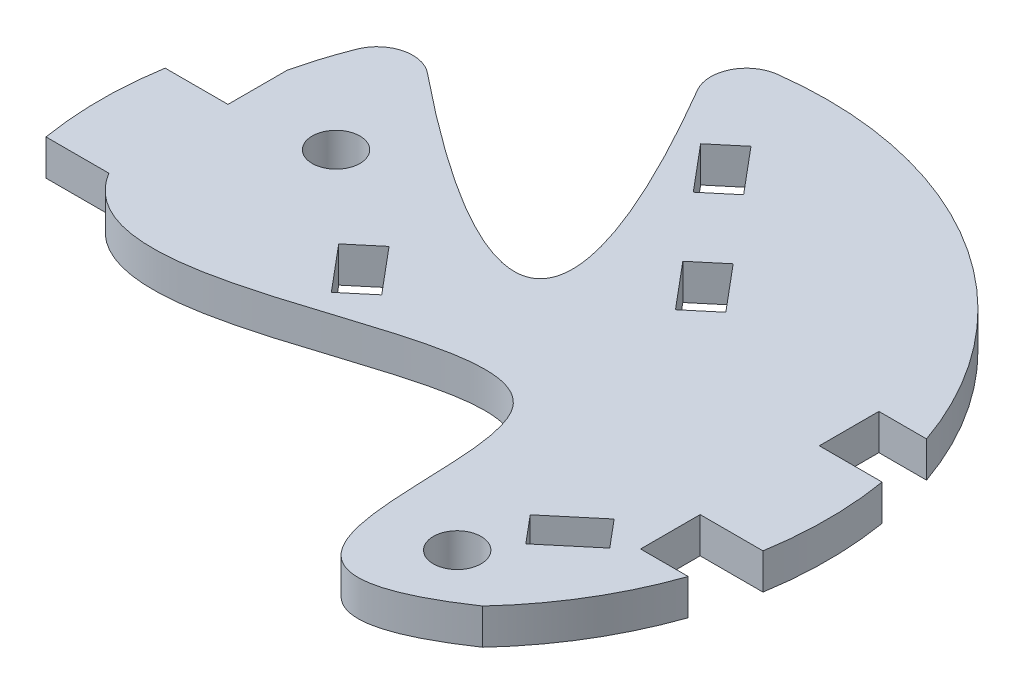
SolidWorks part; units mm, degrees
ref_plane "Alzado" through (0, 0, 0) normal (0, 0, 1) x (1, 0, 0)
ref_plane "Planta" through (0, 0, 0) normal (0, 1, 0) x (1, 0, 0)
ref_plane "Vista lateral" through (0, 0, 0) normal (1, 0, 0) x (0, 0, -1)
sketch "Croquis1" plane through (0, 0, 0) normal (0, 1, 0) x (1, 0, 0)
  circle A0 centre (0, 0) radius 30.5
extrude "Saliente-Extruir1" add sketch "Croquis1" along normal blind 3
sketch "Croquis5" plane through (0, 3, 0) normal (0, 1, 0) x (1, 0, 0)
  line L0 (0, 0) -> (0, 10)
  line L1 (28.8141, -5) -> (30.0874, -5)
  line L2 (28.8141, 5) -> (30.0874, 5)
  line L3 (-24.8141, 10) -> (-28.8141, 10)
  line L4 (24.8141, -5) -> (24.8141, -10)
  line L5 (-24.8141, -10) -> (-28.8141, -10)
  line L6 (24.8141, -5) -> (28.8141, -5)
  line L7 (24.8141, 5) -> (24.8141, 10)
  line L8 (-24.8141, 5) -> (-28.8141, 5)
  line L9 (-24.8141, 5) -> (-24.8141, 10)
  line L10 (-24.8141, -5) -> (-28.8141, -5)
  line L11 (-24.8141, -5) -> (-24.8141, -10)
  line L12 (24.8141, 5) -> (28.8141, 5)
  line L13 (24.8141, -10) -> (28.8141, -10)
  line L14 (24.8141, 10) -> (28.8141, 10)
  line L15 (-28.8141, 5) -> (-30.0874, 5)
  line L16 (-28.8141, -5) -> (-30.0874, -5)
  circle A1 centre (0, 0) radius 30.5 construction
  arc A2 (-28.8141, 10) -> (-30.0874, 5) centre (0, 0) ccw
  arc A3 (28.8141, 10) -> (28.8141, -10) centre (0, 0) cw
  arc A4 (-30.0874, -5) -> (-28.8141, -10) centre (0, 0) ccw
  arc A5 (30.0874, -5) -> (28.8141, -10) centre (0, 0) cw
  arc A6 (28.8141, 10) -> (30.0874, 5) centre (0, 0) cw
extrude "Cortar-Extruir3" cut sketch "Croquis5" against normal blind 4
sketch "Croquis9" plane through (0, 3, 0) normal (0, 1, 0) x (1, 0, 0)
  line L0 (7.2803, 10.7703) -> (22.8679, -7.8063)
  line L1 (-8.3073, 29.3469) -> (7.2803, 10.7703)
  line L2 (7.9714, 14.6138) -> (11.1854, 10.7835)
  line L3 (-24.8141, -5) -> (-24.8141, -10)
  line L4 (-24.8141, -10) -> (-28.8141, -10)
  line L5 (11.1854, 10.7835) -> (8.8872, 8.8552)
  line L6 (-7.7325, 1.4366) -> (-10.0306, -0.4918)
  line L7 (7.9714, 14.6138) -> (5.6733, 12.6854)
  line L8 (-10.0306, -0.4918) -> (-6.8167, -4.322)
  line L9 (-6.8167, -4.322) -> (-4.5186, -2.3936)
  line L10 (21.5273, -8.9312) -> (23.4556, -11.2293)
  line L11 (-2.1205, 21.9737) -> (1.0934, 18.1435)
  line L12 (0.1776, 23.902) -> (3.3916, 20.0718)
  line L13 (-24.8141, 10) -> (-28.8141, 10)
  line L14 (3.3916, 20.0718) -> (1.0934, 18.1435)
  line L15 (0.1776, 23.902) -> (-2.1205, 21.9737)
  line L20 (-7.7325, 1.4366) -> (-4.5186, -2.3936)
  line L21 (17.6971, -12.1451) -> (19.6254, -14.4432)
  line L23 (19.6254, -14.4432) -> (23.4556, -11.2293)
  line L27 (17.6971, -12.1451) -> (21.5273, -8.9312)
  arc A1 (28.8141, 10) -> (-28.8141, 10) centre (0, 0) ccw construction
  circle A4 centre (-16.9835, 6.2386) radius 2
  arc A5 (-28.8141, -10) -> (28.8141, -10) centre (0, 0) ccw construction
  arc A6 (-23.4189, 14.4323) -> (-18.7453, 15.6646) centre (-20.6289, 13.3296) cw
  arc A7 (-28.8141, -10) -> (22.3289, -20.7766) centre (0, 0) ccw
  arc A8 (-28.8141, 10) -> (-8.3073, 29.3469) centre (0, 0) cw
  circle A9 centre (17.204, -17.7804) radius 2
  spline S0 degree 3 poles (22.3289, -20.7766) (5.9738, -31.8512) (22.1768, 15.8352) (-18.2069, -15.8076) (-24.8141, -5) knots 0 0 0 0 0.44579 1 1 1 1
  spline S1 degree 3 poles (-24.8141, -5) (-26.3603, 1.5896) (-25.8363, 8.3159) (-23.4189, 14.4323) knots 0 0 0 0 0.831813 0.831813 0.831813 0.831813
  spline S2 degree 3 poles (-18.7453, 15.6646) (3.867, -2.5765) (8.0942, 2.4964) (-8.3073, 29.3469) knots 0.040528 0.040528 0.040528 0.040528 1 1 1 1
  dimension "D1" = 3
extrude "Cortar-Extruir6" cut sketch "Croquis9" against normal blind 10
fillet "Redondeo1" radius 3 1 edges at (-8.3073, 1.5, -29.3469)
